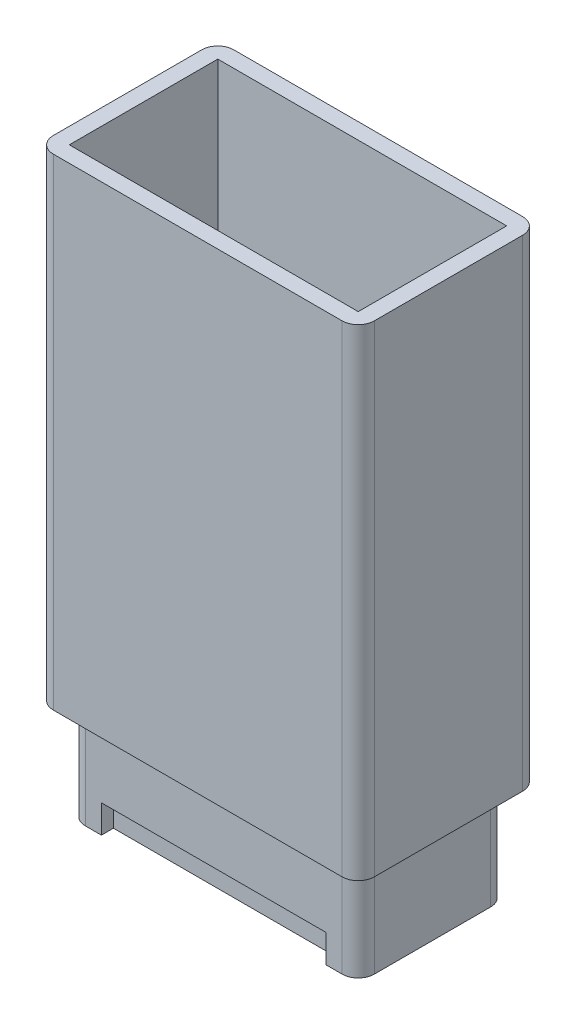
SolidWorks part; units mm, degrees
ref_plane "Ebene vorne" through (0, 0, 0) normal (0, 0, 1) x (1, 0, 0)
ref_plane "Ebene oben" through (0, 0, 0) normal (0, 1, 0) x (1, 0, 0)
ref_plane "Ebene rechts" through (0, 0, 0) normal (1, 0, 0) x (0, 0, -1)
sketch "Skizze1" plane through (0, 0, 0) normal (0, 1, 0) x (1, 0, 0)
  line L1 (40, -22.5) -> (-40, -22.5)
  line L2 (40, -22.5) -> (40, 22.5)
  line L3 (40, 22.5) -> (-40, 22.5)
  line L4 (-40, -22.5) -> (-40, 22.5)
  line L5 (40, -22.5) -> (-40, 22.5) construction
  line L6 (40, 22.5) -> (-40, -22.5) construction
  point P0 (0, 0)
  dimension "D1" = 45
  dimension "D2" = 80
extrude "Aufsatz-Linear austragen1" add sketch "Skizze1" along normal blind 120
sketch "Skizze6" plane through (0, 0, 0) normal (0, 0, 1) x (1, 0, 0)
  line L1 (-40, 120) -> (294.1001, 120)
  line L2 (-40, 120) -> (-40, 162.8242)
  line L3 (-40, 162.8242) -> (294.1001, 162.8242)
  line L4 (294.1001, 120) -> (294.1001, 162.8242)
extrude "Aufsatz-Linear austragen4" [suppressed] add sketch "Skizze6" along normal mid plane 45
sketch "Skizze7" plane through (0, 0, 0) normal (0, -1, 0) x (1, 0, 0)
  line L1 (36, -18.5) -> (-36, -18.5)
  line L2 (36, -18.5) -> (36, 18.5)
  line L3 (36, 18.5) -> (-36, 18.5)
  line L4 (-36, -18.5) -> (-36, 18.5)
  line L5 (36, -18.5) -> (-36, 18.5) construction
  line L6 (36, 18.5) -> (-36, -18.5) construction
  point P0 (0, 0)
  dimension "D1" = 37
  dimension "D2" = 72
extrude "Aufsatz-Linear austragen5" add sketch "Skizze7" along normal blind 25
fillet "Verrundung1" radius 4 4 edges at (36, -12.5, -18.5) (36, -12.5, 18.5) (-36, -12.5, -18.5) (-36, -12.5, 18.5)
shell "Wandung2" thickness 4
fillet "Verrundung2" radius 4 4 edges at (-40, 60, 22.5) (-40, 60, -22.5) (40, 60, -22.5) (40, 60, 22.5)
sketch "Skizze8" plane through (0, 0, 18.5) normal (0, 0, 1) x (1, 0, 0)
  line L0 (32, -25) -> (-32, -25) construction
  line L1 (-28, -25) -> (28, -25)
  line L2 (-28, -25) -> (-28, -18)
  line L3 (-28, -18) -> (28, -18)
  line L4 (28, -25) -> (28, -18)
  line L5 (-28, -25) -> (28, -18) construction
  line L6 (-28, -18) -> (28, -25) construction
  point P0 (0, -21.5)
  point P7 (0, -19.4816)
  point P8 (0, 0)
  dimension "D1" = 56
  dimension "D2" = 7
extrude "Schnitt-Linear austragen1" cut sketch "Skizze8" against normal blind 3
sketch "Skizze9" plane through (0, -25, 0) normal (0, -1, 0) x (1, 0, 0)
  line L0 (32, 14.5) -> (-32, 14.5) construction
  line L1 (-32, 11.5) -> (32, 11.5)
  line L2 (-32, 11.5) -> (-32, 14.5)
  line L3 (-32, 14.5) -> (32, 14.5)
  line L4 (32, 11.5) -> (32, 14.5)
  line L5 (-32, 11.5) -> (32, 14.5) construction
  line L6 (-32, 14.5) -> (32, 11.5) construction
  line L7 (-32, 14.5) -> (-32, -14.5) construction
  point P0 (0, 13)
  point P7 (0, 0)
  dimension "D1" = 3
extrude "Aufsatz-Linear austragen6" add sketch "Skizze9" against normal blind 10
